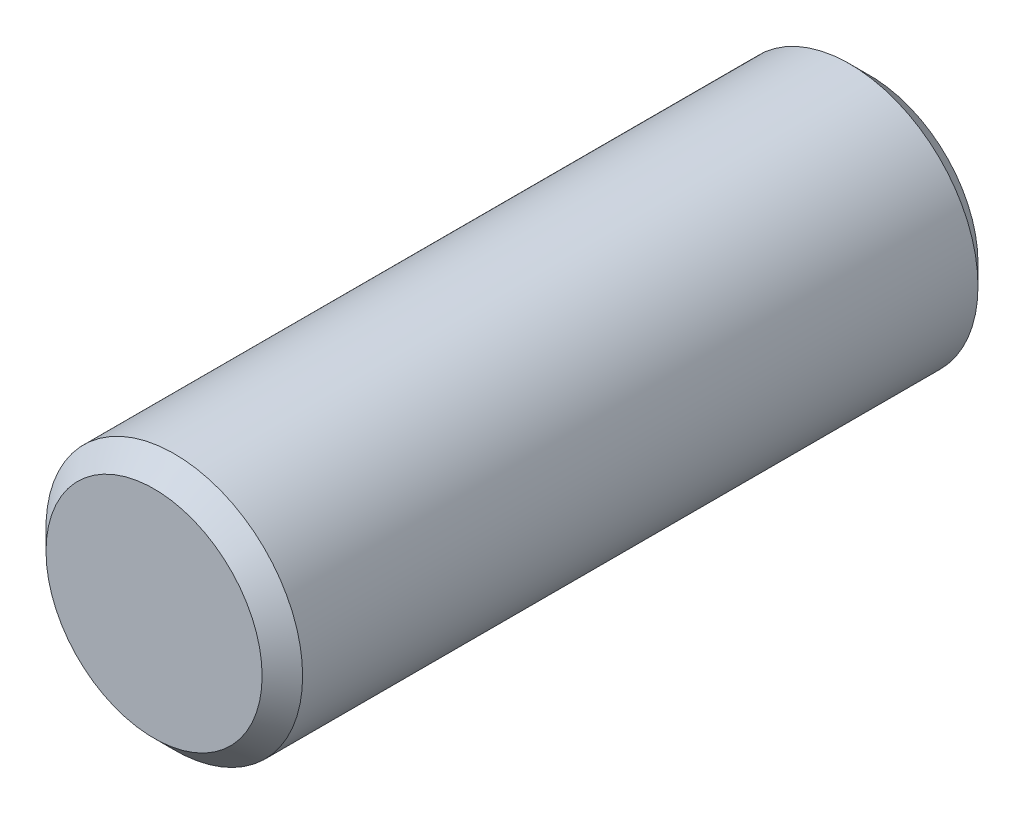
SolidWorks part; units mm, degrees
ref_plane "Front Plane" through (0, 0, 0) normal (0, 0, 1) x (1, 0, 0)
ref_plane "Top Plane" through (0, 0, 0) normal (0, 1, 0) x (1, 0, 0)
ref_plane "Right Plane" through (0, 0, 0) normal (1, 0, 0) x (0, 0, -1)
sketch "Sketch1" plane through (0, 0, 0) normal (0, 0, 1) x (1, 0, 0)
  circle A0 centre (0, 0) radius 4.826
  dimension "D1" = 9.652
extrude "Boss-Extrude1" add sketch "Sketch1" along normal mid plane 26.924
chamfer "Chamfer1" distance 0.762 angle 45 2 edges at (4.826, 0, -13.462) (4.826, 0, 13.462)
sketch "Sketch2" plane through (0, 0, 0) normal (1, 0, 0) x (0, 0, -1)
  line L0 (13.462, -4.064) -> (13.462, 4.064) construction
  line L1 (4.572, -5.693) -> (9.652, -5.693)
  line L2 (4.572, -5.693) -> (4.572, -3.81)
  line L3 (4.572, -3.81) -> (9.652, -3.81)
  line L4 (9.652, -5.693) -> (9.652, -3.81)
  line L5 (4.572, -5.693) -> (9.652, -3.81) construction
  line L6 (4.572, -3.81) -> (9.652, -5.693) construction
  point P0 (7.112, -4.7515)
  dimension "D1" = 6.35
  dimension "D2" = 5.08
  dimension "D3" = 3.81
extrude "Cut-Extrude1" cut sketch "Sketch2" against normal through all both and the other way through all
